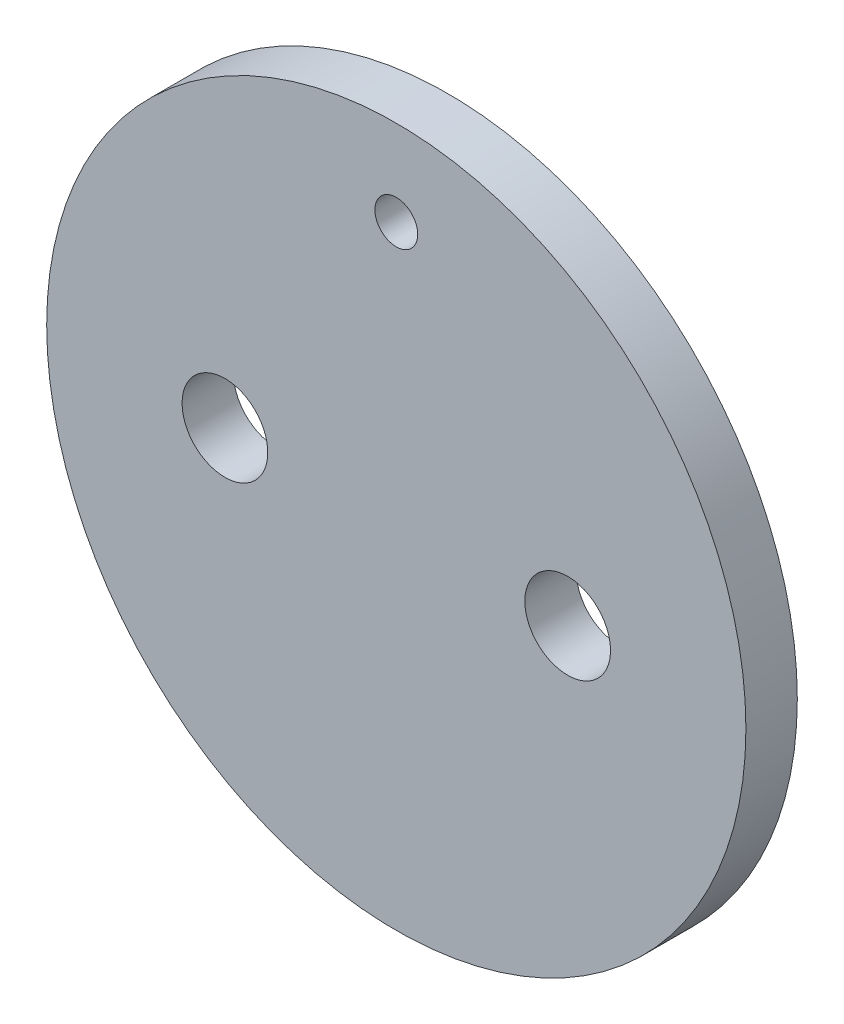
SolidWorks part; units mm, degrees
ref_plane "Front Plane" through (0, 0, 0) normal (0, 0, 1) x (1, 0, 0)
ref_plane "Top Plane" through (0, 0, 0) normal (0, 1, 0) x (1, 0, 0)
ref_plane "Right Plane" through (0, 0, 0) normal (1, 0, 0) x (0, 0, -1)
sketch "Sketch1" plane through (0, 0, 0) normal (0, 0, 1) x (1, 0, 0)
  circle A0 centre (0, 0) radius 25.908
  dimension "D1" = 51.816
extrude "Extrude1" add sketch "Sketch1" along normal blind 3.81
sketch "Sketch2" plane through (0, 0, 0) normal (0, 0, 1) x (1, 0, 0)
  circle A0 centre (0, 19.558) radius 1.5875
  circle A1 centre (12.7, 0) radius 3.175
  circle A2 centre (-12.7, 0) radius 3.175
  dimension "D1" = 3.175
  dimension "D3" = 6.35
  dimension "D4" = 6.35
  dimension "D2" = 19.558
  dimension "D5" = 12.7
  dimension "D6" = 12.7
extrude "Cut-Extrude1" cut sketch "Sketch2" along normal through all
